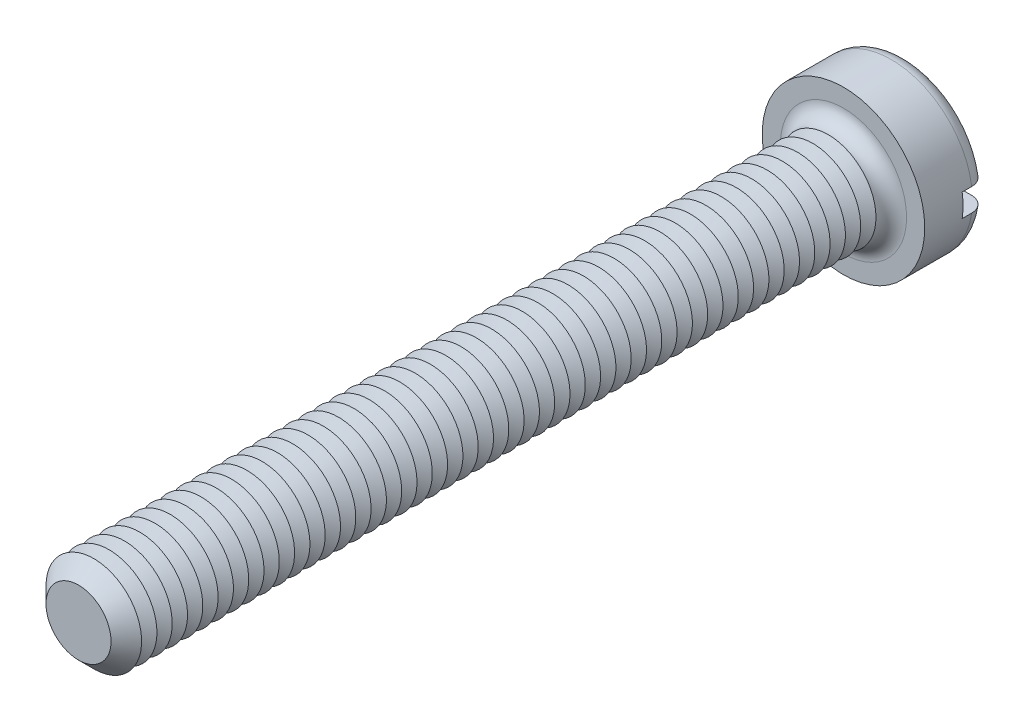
SolidWorks part; units mm, degrees
ref_plane "Front Plane" through (0, 0, 0) normal (0, 0, 1) x (1, 0, 0)
ref_plane "Top Plane" through (0, 0, 0) normal (0, 1, 0) x (1, 0, 0)
ref_plane "Right Plane" through (0, 0, 0) normal (1, 0, 0) x (0, 0, -1)
sketch "Sketch3" plane through (0, 0, 0) normal (0, 0, 1) x (1, 0, 0)
  circle A0 centre (0, 0) radius 4.25
  dimension "D1" = 8.5
extrude "Boss-Extrude2" add sketch "Sketch3" against normal blind 3.3
sketch "Sketch4" plane through (0, 0, 0) normal (0, 0, 1) x (1, 0, 0)
  circle A0 centre (0, 0) radius 2.5
  dimension "D1" = 5
extrude "Boss-Extrude3" add sketch "Sketch4" along normal blind 40
fillet "Fillet1" radius 0.8 2 edges at (4.25, 0, -3.3) (2.5, 0, 0)
chamfer "Chamfer1" distance 0.8 angle 45 1 edges at (2.5, 0, 40)
sketch "Sketch5" plane through (0, 0, 0) normal (1, 0, 0) x (0, 0, -1)
  line L0 (1.6944, 0) -> (-7.6738, 0) construction
sketch "Sketch6" plane through (0, 0, 0) normal (1, 0, 0) x (0, 0, -1)
  line L0 (-0.8, 2.5) -> (-1.2, 1.8072)
  line L1 (-1.2, 1.8072) -> (-1.6, 2.5)
  line L2 (-0.8, 2.5) -> (-39.2, 2.5) construction
  line L3 (-1.6, 2.5) -> (-0.8, 2.5)
  dimension "D1" = 0.8
revolve "Cut-Revolve1" cut sketch "Sketch6" angle 360 about L0
pattern_linear "LPattern1" count 48 spacing 0.8 along (0, 0, 1) of "Cut-Revolve1"
sketch "Sketch8" plane through (0, 0, -3.3) normal (0, 0, -1) x (-1, 0, 0)
  line L1 (4.25, -0.6) -> (-4.25, -0.6)
  line L2 (4.25, -0.6) -> (4.25, 0.6)
  line L3 (4.25, 0.6) -> (-4.25, 0.6)
  line L4 (-4.25, -0.6) -> (-4.25, 0.6)
  line L5 (4.25, -0.6) -> (-4.25, 0.6) construction
  line L6 (4.25, 0.6) -> (-4.25, -0.6) construction
  point P0 (0, 0)
  dimension "D1" = 8.5
  dimension "D2" = 1.2
extrude "Cut-Extrude1" cut sketch "Sketch8" against normal blind 1.3
